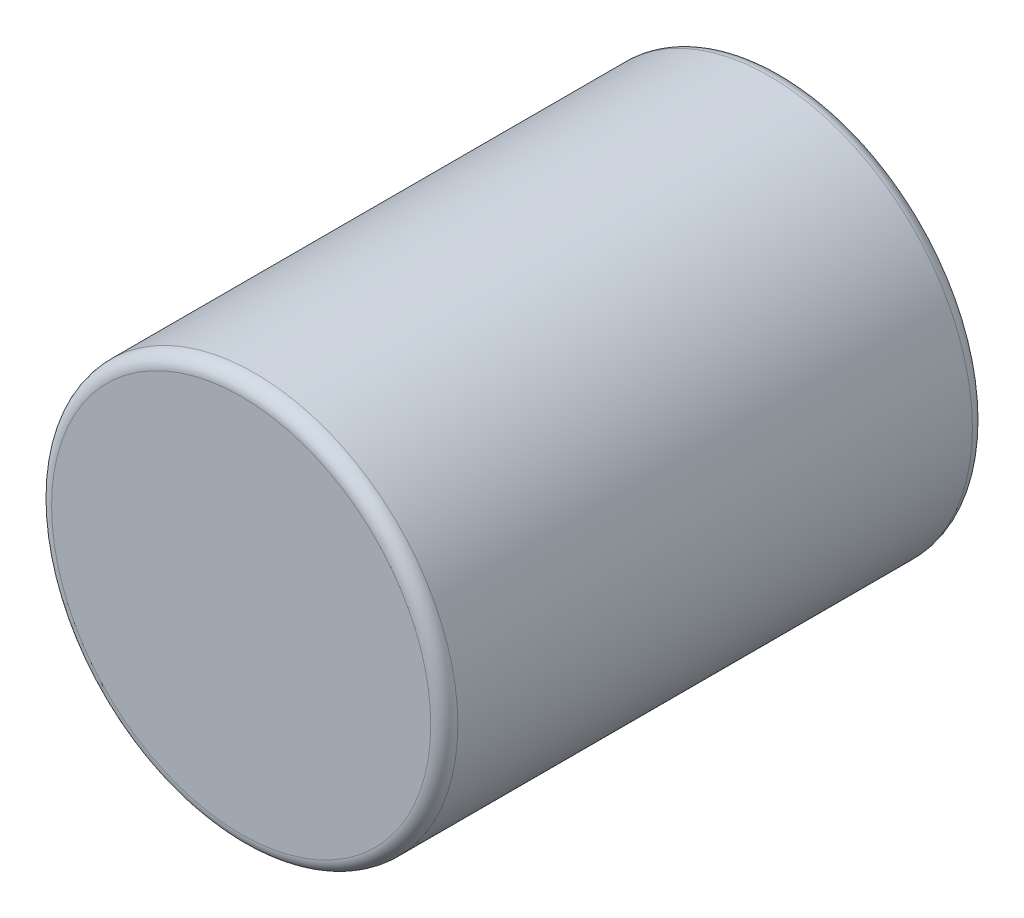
SolidWorks part; units mm, degrees
ref_plane "Plan de face" through (0, 0, 0) normal (0, 0, 1) x (1, 0, 0)
ref_plane "Plan de dessus" through (0, 0, 0) normal (0, 1, 0) x (1, 0, 0)
ref_plane "Plan de droite" through (0, 0, 0) normal (1, 0, 0) x (0, 0, -1)
sketch "Esquisse1" plane through (0, 0, 0) normal (0, 0, 1) x (1, 0, 0)
  circle A0 centre (0, 0) radius 1.5
  dimension "D1" = 3
extrude "Boss.-Extru.1" add sketch "Esquisse1" along normal blind 4
fillet "Congé1" radius 0.1 2 edges at (1.5, 0, 4) (1.5, 0, 0)
